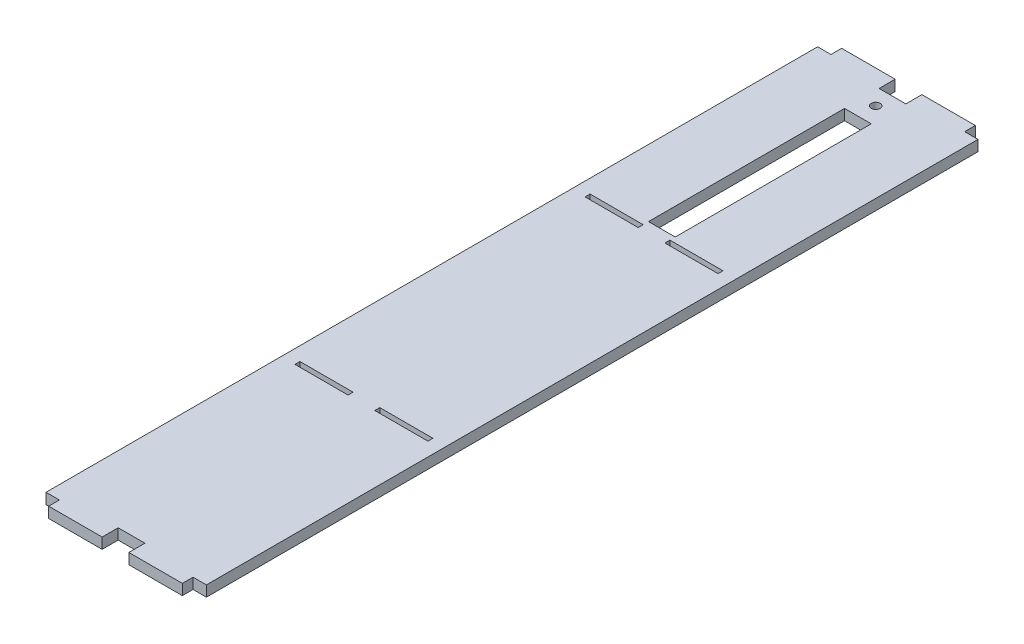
SolidWorks part; units mm, degrees
ref_plane "Alzado" through (0, 0, 0) normal (0, 0, 1) x (1, 0, 0)
ref_plane "Planta" through (0, 0, 0) normal (0, 1, 0) x (1, 0, 0)
ref_plane "Vista lateral" through (0, 0, 0) normal (1, 0, 0) x (0, 0, -1)
sketch "Croquis1" plane through (0, 0, 0) normal (0, 1, 0) x (1, 0, 0)
  line L0 (0, 0) -> (7.5, 0) construction
  line L1 (0, 0) -> (7.5, 0)
  line L2 (0, 0) -> (0, 433)
  line L3 (0, 433) -> (7.5, 433)
  line L4 (90, 0) -> (90, 433)
  line L5 (7.5, 0) -> (7.5, -6) construction
  line L7 (7.5, -6) -> (37.5, -6)
  line L8 (7.5, -6) -> (7.5, 0)
  line L9 (82.5, 0) -> (90, 0)
  line L10 (37.5, -6) -> (37.5, 0)
  line L11 (45, 3) -> (45, 436) construction
  line L12 (0, 216.5) -> (90, 216.5) construction
  line L13 (52.5, -6) -> (52.5, 0)
  line L14 (82.5, -6) -> (52.5, -6)
  line L15 (82.5, -6) -> (82.5, 0)
  line L16 (7.5, 439) -> (7.5, 433)
  line L17 (82.5, 439) -> (82.5, 433)
  line L18 (82.5, 439) -> (52.5, 439)
  line L19 (52.5, 439) -> (52.5, 433)
  line L20 (37.5, 439) -> (37.5, 433)
  line L21 (7.5, 439) -> (37.5, 439)
  line L23 (82.5, 433) -> (90, 433)
  line L25 (90, 0) -> (90, 132) construction
  line L26 (90, 132) -> (82.3, 132) construction
  line L27 (7.7, 132) -> (7.7, 134.8)
  line L28 (82.3, 132) -> (52.5, 132)
  line L29 (82.3, 132) -> (82.3, 134.8)
  line L30 (82.3, 134.8) -> (52.5, 134.8)
  line L31 (52.5, 132) -> (52.5, 134.8)
  line L32 (7.7, 132) -> (37.5, 132)
  line L33 (37.5, 132) -> (37.5, 134.8)
  line L34 (7.7, 134.8) -> (37.5, 134.8)
  line L35 (82.3, 134.8) -> (82.3, 294.8) construction
  line L36 (82.3, 214.8) -> (45, 214.8) construction
  line L37 (82.3, 297.6) -> (82.3, 294.8)
  line L38 (82.3, 297.6) -> (52.5, 297.6)
  line L39 (52.5, 297.6) -> (52.5, 294.8)
  line L40 (82.3, 294.8) -> (52.5, 294.8)
  line L41 (7.7, 297.6) -> (7.7, 294.8)
  line L42 (7.7, 294.8) -> (37.5, 294.8)
  line L43 (37.5, 297.6) -> (37.5, 294.8)
  line L44 (7.7, 297.6) -> (37.5, 297.6)
  line L46 (37.5, 410.6) -> (52.5, 410.6)
  line L47 (37.5, 410.6) -> (37.5, 300.6)
  line L48 (37.5, 300.6) -> (52.5, 300.6)
  line L49 (52.5, 410.6) -> (52.5, 300.6)
  line L50 (37.5, 0) -> (37.5, 3)
  line L51 (37.5, 433) -> (37.5, 430)
  line L52 (37.5, 430) -> (52.5, 430)
  line L53 (52.5, 433) -> (52.5, 430)
  line L54 (37.5, 3) -> (52.5, 3)
  line L55 (52.5, 0) -> (52.5, 3)
  circle A0 centre (45, 420.6) radius 2.5
  point P48 (67.4, 297.6)
  dimension "D18" = 5
  dimension "D19" = 10
  dimension "D1" = 433
  dimension "D2" = 90
  dimension "D3" = 7.5
  dimension "D4" = 6
  dimension "D5" = 30
  dimension "D6" = 7.5
  dimension "D7" = 132
  dimension "D8" = 7.7
  dimension "D9" = 29.8
  dimension "D10" = 2.8
  dimension "D11" = 160
  dimension "D12" = 110
  dimension "D13" = 3
  dimension "D14" = 15
  dimension "D15" = 37.5
  dimension "D16" = 3
  dimension "D17" = 3
extrude "Saliente-Extruir1" add sketch "Croquis1" along normal blind 6
